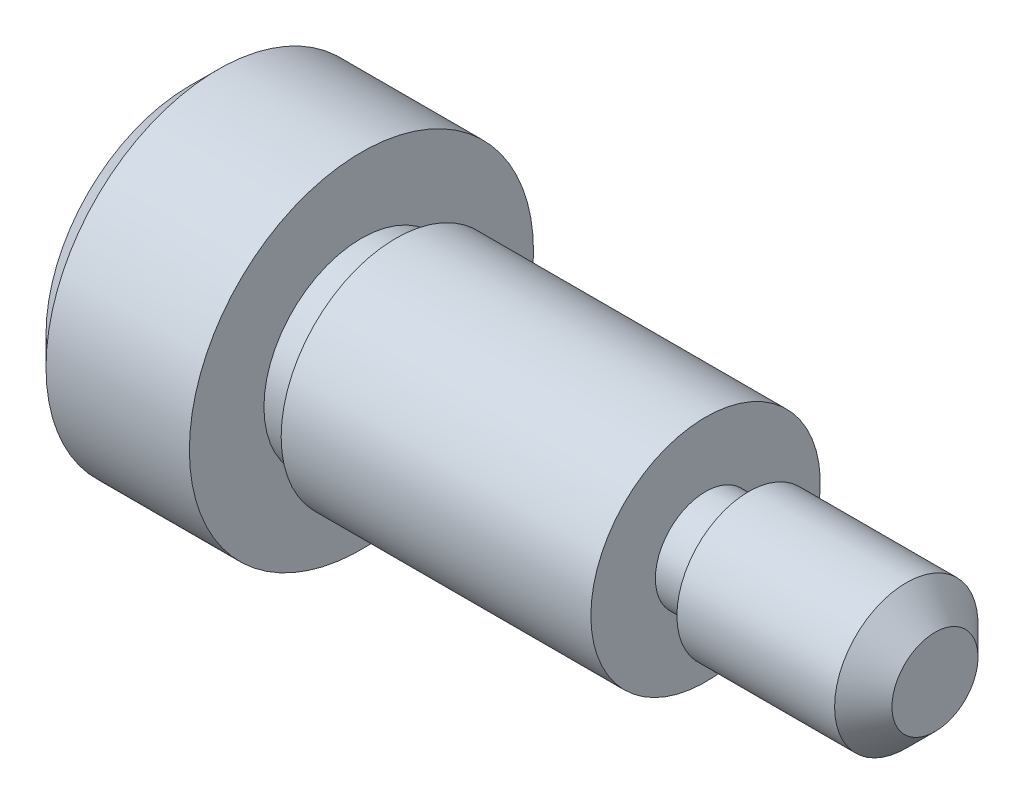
SolidWorks part; units mm, degrees
ref_plane "Front Plane" through (0, 0, 0) normal (0, 0, 1) x (1, 0, 0)
ref_plane "Top Plane" through (0, 0, 0) normal (0, 1, 0) x (1, 0, 0)
ref_plane "Right Plane" through (0, 0, 0) normal (1, 0, 0) x (0, 0, -1)
sketch "body sketch" plane through (0, 0, 0) normal (0, 0, 1) x (1, 0, 0)
  line L0 (-3, 0) -> (10, 0)
  line L1 (10, 0) -> (10, 1.25)
  line L2 (10, 1.25) -> (6, 1.25)
  line L3 (6, 1.25) -> (6, 2)
  line L4 (6, 2) -> (0, 2)
  line L5 (0, 2) -> (0, 3)
  line L6 (0, 3) -> (-3, 3)
  line L7 (-3, 3) -> (-3, 0)
  line L8 (0, 0) -> (21.8609, 0) construction
  dimension "head height" = 3
  dimension "shoulder length" = 6
  dimension "thread length" = 4
  dimension "thread dia" = 2.5
  dimension "shoulder dia" = 4
  dimension "head dia" = 6
revolve "body" add sketch "body sketch" angle 360 about L8
sketch "undercut sketch" plane through (0, 0, 0) normal (0, 0, 1) x (1, 0, 0)
  line L0 (6, 2) -> (0, 2) construction
  line L1 (0.6, 2) -> (0, 2)
  line L2 (0.6, 2) -> (0.6, 1.7)
  line L3 (0.6, 1.7) -> (0, 1.7)
  line L4 (0, 2) -> (0, 1.7)
  line L5 (0, -2) -> (0, 2) construction
  line L6 (10, 1.25) -> (6, 1.25) construction
  line L7 (6.75, 1.25) -> (6, 1.25)
  line L8 (6.75, 1.25) -> (6.75, 0.875)
  line L9 (6.75, 0.875) -> (6, 0.875)
  line L10 (6, 1.25) -> (6, 0.875)
  line L11 (6, -1.25) -> (6, 1.25) construction
  line L12 (0, 0) -> (6.75, 0) construction
  line L13 (0.3, 2) -> (0.6, 1.7) construction
  line L14 (0.6, 1.7) -> (1.0458, 1.4588) construction
  line L15 (6.375, 1.25) -> (6.75, 0.875) construction
  dimension "D1" = 45
  dimension "shoulderwidth" = 0.6
  dimension "D2" = 45
  dimension "thd width" = 0.75
revolve "undercut" cut sketch "undercut sketch" angle 360 about L12
sketch "hex socket sketch" plane through (-3, 0, 0) normal (-1, 0, 0) x (0, 0, 1)
  line L1 (0.5774, 1) -> (-0.5774, 1)
  line L2 (-0.5774, 1) -> (-1.1547, 0)
  line L3 (-1.1547, 0) -> (-0.5774, -1)
  line L4 (-0.5774, -1) -> (0.5774, -1)
  line L5 (0.5774, -1) -> (1.1547, 0)
  line L6 (1.1547, 0) -> (0.5774, 1)
  circle A0 centre (0, 0) radius 1 construction
  dimension "socket dia" = 2
extrude "hex socket" cut sketch "hex socket sketch" against normal blind 1.6
chamfer "Chamfer" distance 0.5 angle 45 2 edges at (-3, 0, 3) (10, 0, 1.25)
